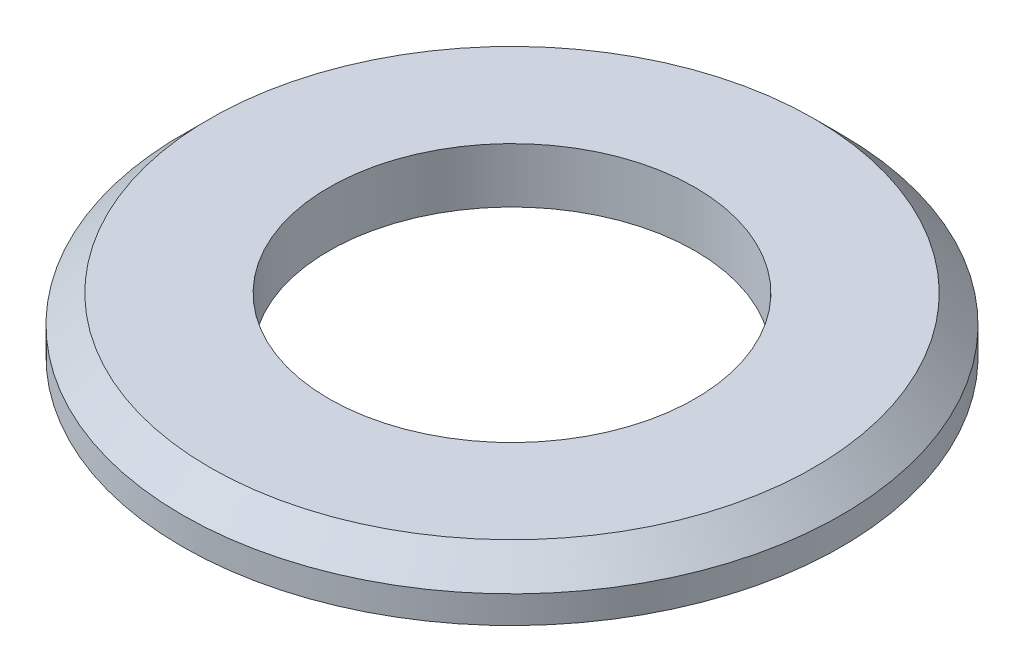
SolidWorks part; units mm, degrees
ref_plane "Front" through (0, 0, 0) normal (0, 0, 1) x (1, 0, 0)
ref_plane "Top" through (0, 0, 0) normal (0, 1, 0) x (1, 0, 0)
ref_plane "Right" through (0, 0, 0) normal (1, 0, 0) x (0, 0, -1)
sketch "Sketch1" plane through (0, 0, 0) normal (0, 1, 0) x (1, 0, 0)
  circle A0 centre (0, 0) radius 20
  circle A1 centre (0, 0) radius 36
extrude "Extrude1" add sketch "Sketch1" along normal blind 6
chamfer "Chamfer1" distance 3 1 edges at (0, 6, 36)
